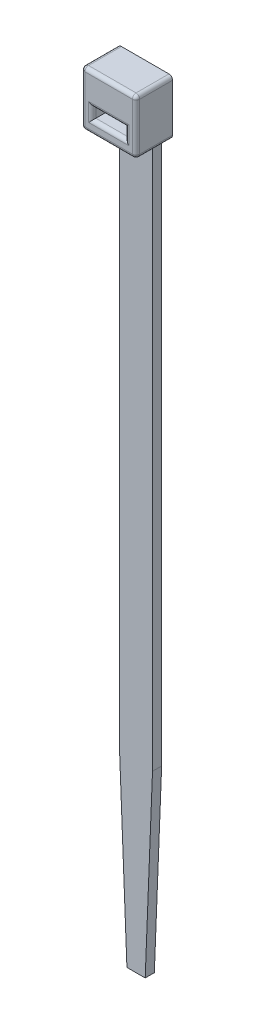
SolidWorks part; units mm, degrees
ref_plane "Front Plane" through (0, 0, 0) normal (0, 0, 1) x (1, 0, 0)
ref_plane "Top Plane" through (0, 0, 0) normal (0, 1, 0) x (1, 0, 0)
ref_plane "Right Plane" through (0, 0, 0) normal (1, 0, 0) x (0, 0, -1)
sketch "Sketch1" plane through (0, 0, 0) normal (0, 0, 1) x (1, 0, 0)
  line L0 (0, 0) -> (1.016, -25.4)
  line L1 (0, 0) -> (4.572, 0) construction
  line L2 (0, 0) -> (0, 76.2)
  line L3 (0, 76.2) -> (4.572, 76.2)
  line L4 (4.572, 0) -> (4.572, 76.2)
  line L5 (1.016, -25.4) -> (3.556, -25.4)
  line L6 (3.556, -25.4) -> (4.572, 0)
  point P5 (2.286, -25.4)
  point P8 (2.286, 0)
  dimension "D1" = 2.54
  dimension "D2" = 25.4
  dimension "D3" = 4.572
  dimension "D4" = 76.2
extrude "Boss-Extrude1" add sketch "Sketch1" along normal blind 1.27
sketch "Sketch2" plane through (0, 0, 0) normal (0, 0, -1) x (-1, 0, 0)
  line L0 (-4.572, 76.2) -> (0, 76.2) construction
  line L1 (-6.096, 76.2) -> (1.524, 76.2)
  line L2 (-6.096, 76.2) -> (-6.096, 83.82)
  line L3 (-6.096, 83.82) -> (1.524, 83.82)
  line L4 (1.524, 76.2) -> (1.524, 83.82)
  line L6 (-4.572, 77.978) -> (0, 77.978)
  line L7 (-4.572, 77.978) -> (-4.572, 79.502)
  line L8 (-4.572, 79.502) -> (0, 79.502)
  line L9 (0, 77.978) -> (0, 79.502)
  point P6 (-2.286, 76.2)
  point P7 (-2.286, 76.2)
  point P12 (0, 0)
  point P14 (0, 0)
  dimension "D1" = 7.62
  dimension "D2" = 7.62
  dimension "D3" = 1.524
  dimension "D4" = 1.778
extrude "Boss-Extrude2" add sketch "Sketch2" against normal blind 5.08
fillet "Fillet1" radius 0.508 12 edges at (2.286, 76.2, 5.08) (-1.524, 80.01, 5.08) (2.286, 83.82, 5.08) (6.096, 80.01, 5.08) (2.286, 79.502, 5.08) (0, 78.74, 5.08) (2.286, 77.978, 5.08) (4.572, 78.74, 5.08) (-1.524, 76.2, 2.54) (6.096, 76.2, 2.54) (-1.524, 83.82, 2.54) (6.096, 83.82, 2.54)
ref_plane "Plane1" through (2.286, 0, 0) normal (-1, 0, 0) x (0, 0, 1)
sketch "Sketch3" plane through (2.286, 0, 0) normal (-1, 0, 0) x (0, 0, 1)
  line L0 (0, 69.342) -> (0.254, 69.342)
  line L1 (0.254, 69.342) -> (0, 69.85)
  line L2 (0, 76.2) -> (0, 0) construction
  line L3 (0, 69.85) -> (0, 69.342)
  dimension "D1" = 0.254
  dimension "D2" = 0.508
  dimension "D3" = 6.35
extrude "Cut-Extrude1" cut sketch "Sketch3" against normal mid plane 3.81
pattern_linear "LPattern1" count 90 spacing 0.762 along (0, -1, 0) of "Cut-Extrude1"
